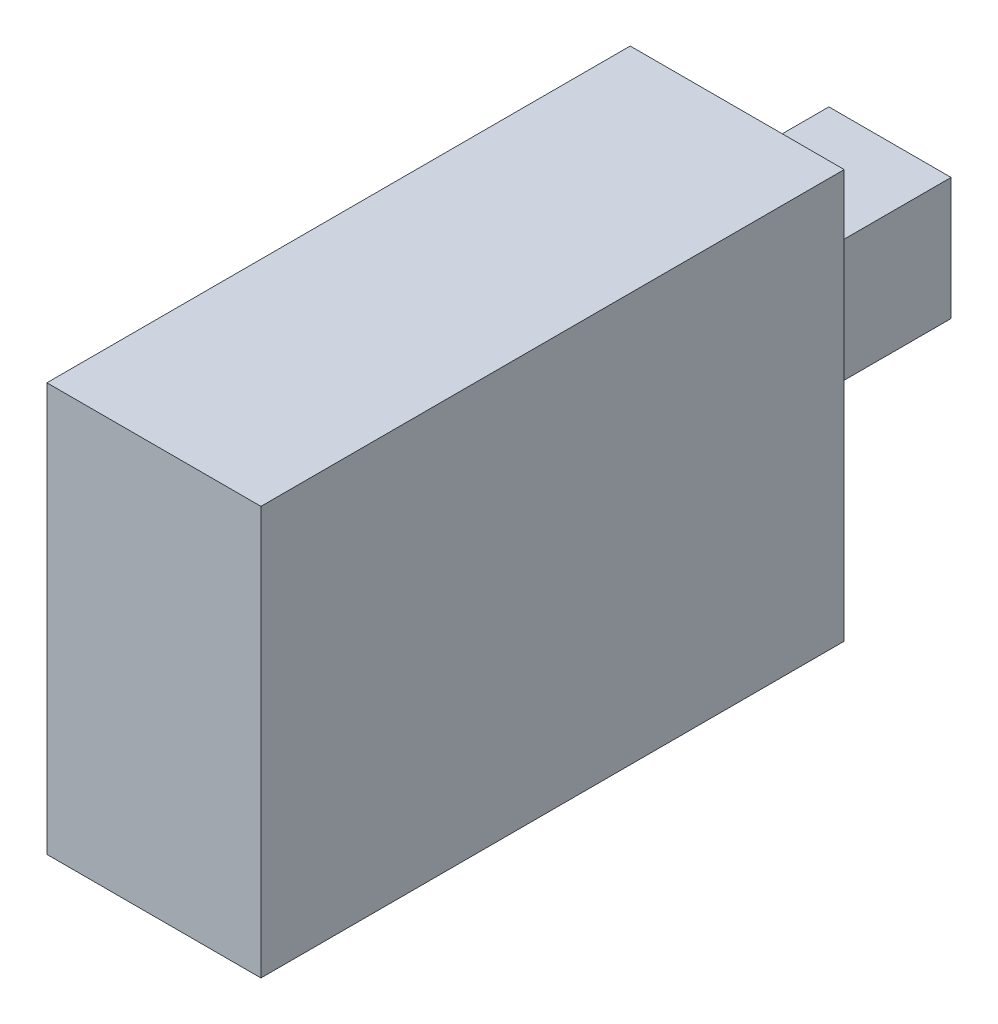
SolidWorks part; units mm, degrees
ref_plane "Front Plane" through (0, 0, 0) normal (0, 0, 1) x (1, 0, 0)
ref_plane "Top Plane" through (0, 0, 0) normal (0, 1, 0) x (1, 0, 0)
ref_plane "Right Plane" through (0, 0, 0) normal (1, 0, 0) x (0, 0, -1)
sketch "Sketch1" plane through (0, 0, 0) normal (0, 0, 1) x (1, 0, 0)
  line L0 (-3.3274, -6.35) -> (3.3274, -6.35)
  line L1 (3.3274, 6.35) -> (3.3274, -6.35)
  line L2 (-3.3274, 6.35) -> (3.3274, 6.35)
  line L3 (-3.3274, 6.35) -> (-3.3274, -6.35)
  line L4 (0, 6.35) -> (0, -6.35) construction
  dimension "D1" = 6.6548
  dimension "D2" = 12.7
extrude "Extrude1" add sketch "Sketch1" along normal mid plane 18.136
sketch "Sketch2" plane through (0, 0, -9.068) normal (0, 0, -1) x (-1, 0, 0)
  line L0 (1.9, 3.05) -> (1.9, -0.75)
  line L1 (1.9, -0.75) -> (-1.9, -0.75)
  line L2 (-1.9, -0.75) -> (-1.9, 3.05)
  line L3 (-1.9, 3.05) -> (1.9, 3.05)
  line L4 (0, -0.75) -> (0, 3.05) construction
  line L5 (-3.3274, 6.35) -> (3.3274, 6.35) construction
  dimension "D1" = 3.8
  dimension "D2" = 3.3
extrude "Extrude2" add sketch "Sketch2" along normal blind 4.75
